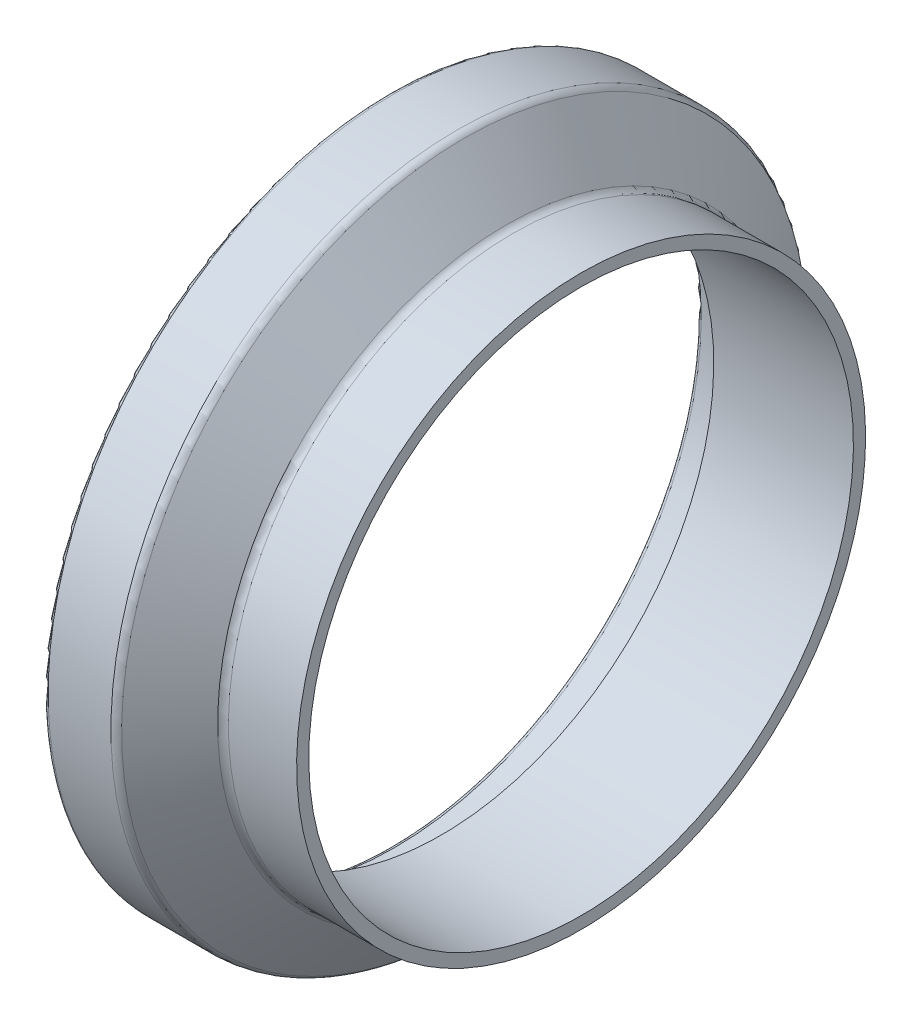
SolidWorks part; units mm, degrees
ref_plane "Front Plane" through (0, 0, 0) normal (0, 0, 1) x (1, 0, 0)
ref_plane "Top Plane" through (0, 0, 0) normal (0, 1, 0) x (1, 0, 0)
ref_plane "Right Plane" through (0, 0, 0) normal (1, 0, 0) x (0, 0, -1)
sketch "Sketch1" plane through (0, 0, 0) normal (0, 0, 1) x (1, 0, 0)
  line L0 (0, 0) -> (-52.2554, 0) construction
  line L1 (-1.652, 48.6283) -> (-26.5948, 48.6283)
  line L2 (-26.5948, 48.6283) -> (-26.5948, 53.9623)
  line L3 (-27.4076, 54.7751) -> (-34.9768, 54.7751)
  line L4 (-35.7896, 55.5879) -> (-35.7896, 61.0362)
  line L5 (-34.9768, 61.849) -> (-23.7604, 61.849)
  line L6 (-22.4824, 61.2118) -> (-15.1167, 51.4372)
  line L7 (-13.8387, 50.8) -> (-1.652, 50.8)
  line L8 (-1.652, 50.8) -> (-1.652, 48.6283)
  arc A0 (-34.9768, 61.849) -> (-35.7896, 61.0362) centre (-34.9768, 61.0362) ccw
  arc A1 (-35.7896, 55.5879) -> (-34.9768, 54.7751) centre (-34.9768, 55.5879) ccw
  arc A2 (-27.4076, 54.7751) -> (-26.5948, 53.9623) centre (-27.4076, 53.9623) cw
  arc A3 (-13.8387, 50.8) -> (-15.1167, 51.4372) centre (-13.8387, 52.4002) cw
  arc A4 (-22.4824, 61.2118) -> (-23.7604, 61.849) centre (-23.7604, 60.2488) ccw
  point P13 (-35.7896, 61.849)
  point P16 (-35.7896, 54.7751)
  point P23 (-22.9626, 61.849)
  dimension "D9" = 0.8128
  dimension "D10" = 1.6002
  dimension "D1" = 61.849
  dimension "D2" = 37
  dimension "D3" = 54.7751
  dimension "D4" = 48.6283
  dimension "D5" = 12.827
  dimension "D6" = 9.1948
  dimension "D7" = 34.1376
  dimension "D8" = 50.8
revolve "Revolve1" add sketch "Sketch1" angle 360 about L0
